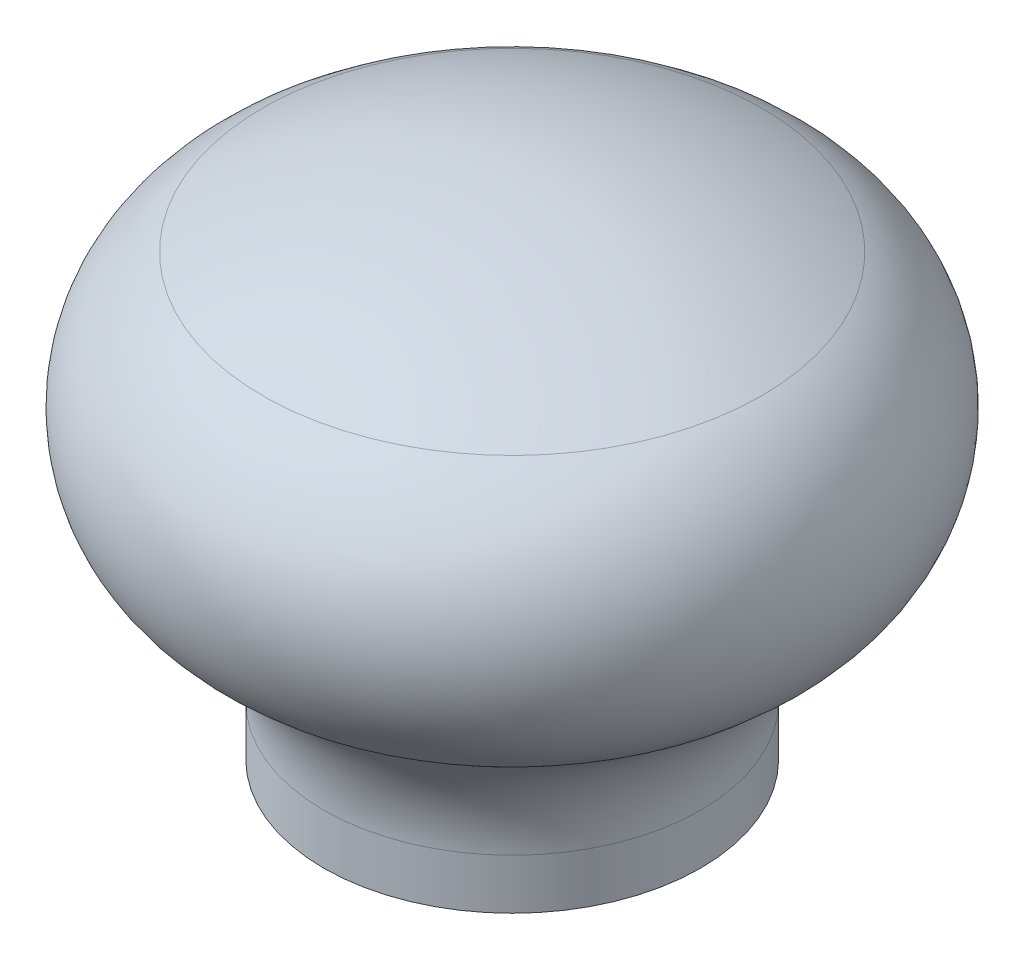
SolidWorks part; units mm, degrees
ref_plane "Front Plane" through (0, 0, 0) normal (0, 0, 1) x (1, 0, 0)
ref_plane "Top Plane" through (0, 0, 0) normal (0, 1, 0) x (1, 0, 0)
ref_plane "Right Plane" through (0, 0, 0) normal (1, 0, 0) x (0, 0, -1)
sketch "Sketch1" plane through (0, 0, 0) normal (0, 0, 1) x (1, 0, 0)
  line L0 (-9.525, 0) -> (9.525, 0)
  line L1 (-16.6687, 25.4) -> (16.6688, 25.4) construction
  line L2 (-16.6687, 25.4) -> (-16.6688, 0) construction
  line L3 (-16.6688, 0) -> (16.6688, 0) construction
  line L4 (16.6688, 25.4) -> (16.6688, 0) construction
  line L5 (-9.525, 0) -> (-9.525, 2.54)
  line L6 (-2.0828, 9.2639) -> (2.0828, 9.2639)
  line L7 (-2.0828, 9.2639) -> (-2.0828, 0)
  line L8 (-2.0828, 0) -> (2.0828, 0)
  line L9 (2.0828, 9.2639) -> (2.0828, 0)
  line L10 (9.525, 0) -> (9.525, 2.54)
  line L11 (-16.6687, 22.225) -> (16.6687, 22.225) construction
  line L12 (-16.6687, 8.89) -> (16.6687, 8.89) construction
  line L13 (-16.6687, 2.54) -> (16.6687, 2.54) construction
  arc A0 (-9.525, 2.54) -> (-13.044, 8.89) centre (-17.0138, 2.54) ccw
  arc A1 (9.525, 2.54) -> (13.044, 8.89) centre (17.0138, 2.54) cw
  arc A2 (-12.6082, 22.225) -> (12.6082, 22.225) centre (0, -1.2214) cw
  arc A3 (-13.044, 8.89) -> (-12.6082, 22.225) centre (-8.9547, 15.431) cw
  arc A4 (13.044, 8.89) -> (12.6082, 22.225) centre (8.9547, 15.431) ccw
  point P11 (0, 0)
sketch "Sketch2" plane through (0, 0, 0) normal (0, 0, 1) x (1, 0, 0)
  line L0 (-9.525, 0) -> (-9.525, 2.54) construction
  line L1 (-9.525, 0) -> (9.525, 0) construction
  line L2 (-2.0828, 9.2639) -> (-2.0828, 0) construction
  line L3 (-2.0828, 9.2639) -> (2.0828, 9.2639) construction
  line L4 (-9.525, 0) -> (-9.525, 2.54)
  line L5 (-9.525, 0) -> (-2.0828, 0)
  line L6 (-2.0828, 9.2639) -> (-2.0828, 0)
  line L7 (-2.0828, 9.2639) -> (0, 9.2639)
  line L8 (0, 0) -> (0, 25.4) construction
  line L9 (0, 9.2639) -> (0, 25.4)
  arc A0 (12.6082, 22.225) -> (-12.6082, 22.225) centre (0, -1.2214) ccw construction
  arc A1 (-12.6082, 22.225) -> (-13.044, 8.89) centre (-8.9547, 15.431) ccw construction
  arc A2 (-9.525, 2.54) -> (-13.044, 8.89) centre (-17.0138, 2.54) ccw construction
  arc A3 (0, 25.4) -> (-12.6082, 22.225) centre (0, -1.2214) ccw
  arc A4 (-12.6082, 22.225) -> (-13.044, 8.89) centre (-8.9547, 15.431) ccw
  arc A5 (-9.525, 2.54) -> (-13.044, 8.89) centre (-17.0138, 2.54) ccw
revolve "Revolve1" add sketch "Sketch2" angle 360 about L8
equation "\"D1@Sketch1\" = \"C@Sketch1\"*.1"
equation "\"D3@Sketch1\" = \"C@Sketch1\"*.25"
equation "\"D4@Sketch1\" = \"C@Sketch1\"*.525"
